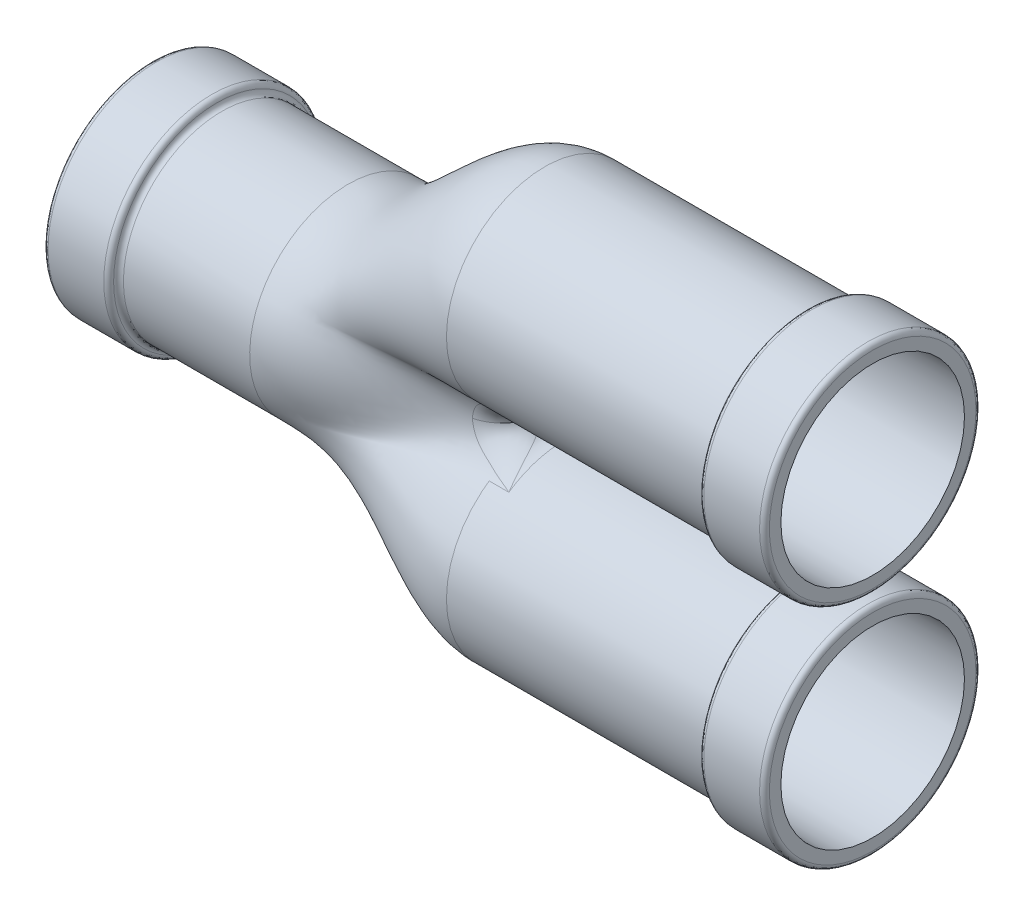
SolidWorks part; units mm, degrees
ref_plane "Front Plane" through (0, 0, 0) normal (0, 0, 1) x (1, 0, 0)
ref_plane "Top Plane" through (0, 0, 0) normal (0, 1, 0) x (1, 0, 0)
ref_plane "Right Plane" through (0, 0, 0) normal (1, 0, 0) x (0, 0, -1)
sketch "Sketch1" plane through (0, 0, 0) normal (0, 0, 1) x (1, 0, 0)
  line L0 (0, 0) -> (30, 0) construction
  line L1 (30, 0) -> (60, 17.3205) construction
  line L2 (30, 0) -> (60, -17.3205) construction
  line L3 (60, 17.3205) -> (110, 17.3205) construction
  line L4 (60, -17.3205) -> (110, -17.3205) construction
  dimension "D1" = 30
  dimension "D2" = 150
  dimension "D3" = 30
  dimension "D4" = 50
  dimension "D5" = 30
  dimension "D6" = 50
  dimension "D7" = 150
ref_plane "Plane2" through (30, 0, 0) normal (1, 0, 0) x (0, 0, -1)
ref_plane "Plane3" through (60, 0, 0) normal (1, 0, 0) x (0, 0, -1)
ref_plane "Plane4" through (110, 0, 0) normal (1, 0, 0) x (0, 0, -1)
sketch "Sketch4" plane through (30, 0, 0) normal (1, 0, 0) x (0, 0, -1)
  circle A0 centre (0, 0) radius 15
  dimension "D1" = 30
sketch "Sketch5" plane through (60, 0, 0) normal (1, 0, 0) x (0, 0, -1)
  line L0 (0, 17.3205) -> (0, -17.3205) construction
  arc A0 (8.4817, 4.9487) -> (-8.4817, 4.9487) centre (0, 17.3205) ccw
  arc A1 (-8.4817, -4.9487) -> (8.4817, -4.9487) centre (0, -17.3205) ccw
  arc A2 (8.4817, -4.9487) -> (8.4817, 4.9487) centre (11.8743, 0) cw
  arc A3 (-8.4817, -4.9487) -> (-8.4817, 4.9487) centre (-11.8743, 0) ccw
  dimension "D1" = 30
  dimension "D2" = 6
loft "Loft1" add profiles "Sketch4", "Sketch5"
sketch "Sketch6" plane through (30, 0, 0) normal (-1, 0, 0) x (0, 0, 1)
  circle A1 centre (0, 0) radius 15
  circle A2 centre (0, 0) radius 15
  dimension "D1" = 0
extrude "Boss-Extrude2" add sketch "Sketch6" along normal blind 30
sketch "Sketch7" plane through (60, 0, 0) normal (1, 0, 0) x (0, 0, -1)
  circle A0 centre (0, -17.3205) radius 15
  circle A1 centre (0, 17.3205) radius 15
  dimension "D1" = 30
extrude "Boss-Extrude3" add sketch "Sketch7" along normal up to vertex
ref_plane "Plane5" through (45, 0, 0) normal (1, 0, 0) x (0, 0, -1)
fillet "Fillet14" radius 3 2 edges
fillet "Fillet15" radius 6 4 edges at (60.8767, 2.8817, 6.612) (60.8766, 2.8817, -6.612) (60.8767, -2.8817, -6.612) (60.8766, -2.8817, 6.612)
sketch "Sketch10" plane through (110, 0, 0) normal (1, 0, 0) x (0, 0, -1)
  circle A2 centre (0, -17.3205) radius 12
  circle A3 centre (0, -17.3205) radius 12
  circle A5 centre (0, 17.3205) radius 12
  circle A6 centre (0, 17.3205) radius 12
  dimension "D1" = 3
  dimension "D2" = 3
shell "Shell5" thickness 1
sketch "Sketch23" plane through (0, 0, 0) normal (-1, 0, 0) x (0, 0, 1)
  circle A0 centre (0, 0) radius 15 construction
  circle A1 centre (0, 0) radius 15
  circle A3 centre (0, 0) radius 16.5
  circle A4 centre (0, 0) radius 16.5
  dimension "D1" = 1.5
extrude "Boss-Extrude7" add sketch "Sketch23" against normal blind 10
fillet "Fillet16" radius 0.75 3 edges at (10, 0, 15) (10, 0, 16.5) (0, 0, 16.5)
sketch "Sketch24" plane through (110, 0, 0) normal (1, 0, 0) x (0, 0, -1)
  circle A0 centre (0, 17.3205) radius 15 construction
  circle A1 centre (0, -17.3205) radius 15 construction
  circle A2 centre (0, 17.3205) radius 16.5
  circle A3 centre (0, 17.3205) radius 16.5
  circle A4 centre (0, 17.3205) radius 15
  circle A5 centre (0, -17.3205) radius 15
  circle A6 centre (0, -17.3205) radius 16.5
  circle A7 centre (0, -17.3205) radius 16.5
  dimension "D1" = 1.5
  dimension "D2" = 1.5
extrude "Boss-Extrude8" add sketch "Sketch24" against normal blind 10
fillet "Fillet17" radius 0.75 6 edges at (100, -17.3205, -16.5) (100, -17.3205, -15) (110, -17.3205, -16.5) (110, 17.3205, -16.5) (100, 17.3205, -15) (100, 17.3205, -16.5)
